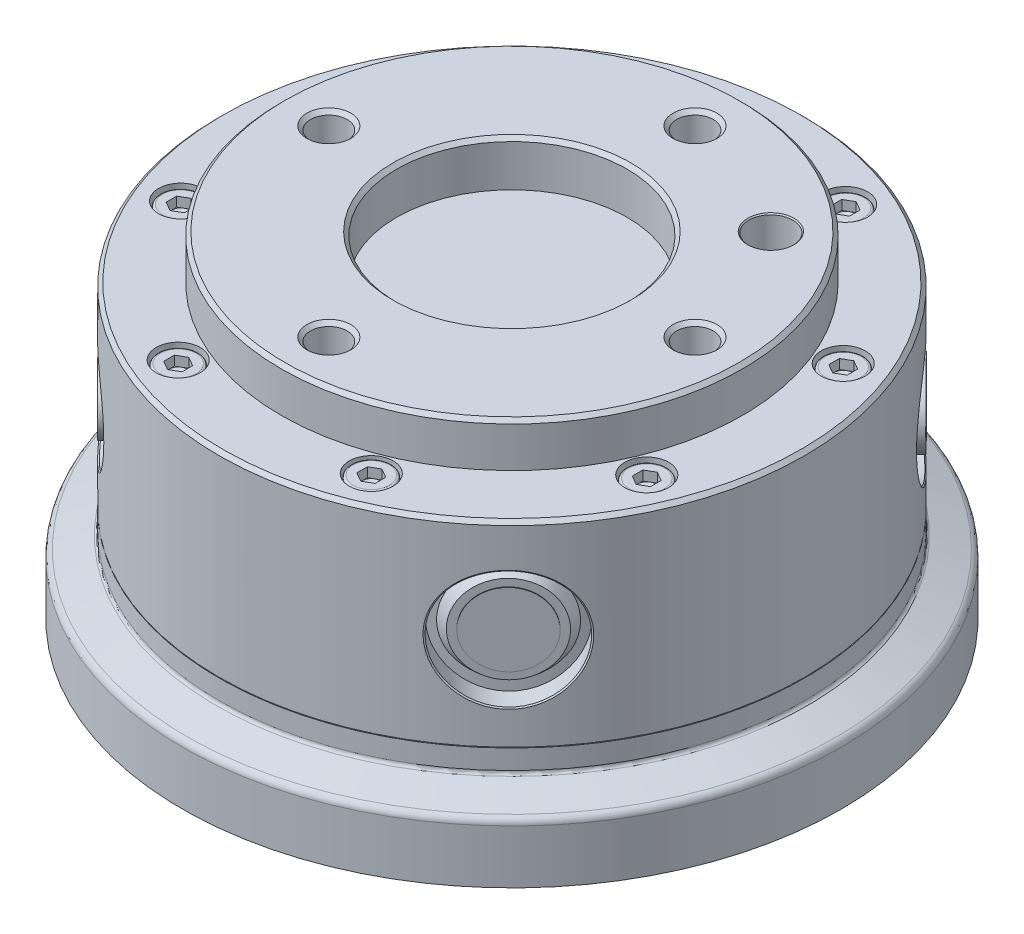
SolidWorks part; units mm, degrees
other "<4.0.08.2008488>-<移动面1>"
other "<4.0.08.2008488>-<移动面1>"
other "<4.0.08.2008488>-<移动面1>"
other "<4.0.08.2008488>-<移动面1>"
other "<4.0.08.2008488>-<移动面1>"
other "<4.0.08.2008488>-<移动面1>"
other "<4.0.08.2008488>-<移动面1>"
other "<4.0.08.2008488>-<移动面1>"
other "<2.2.08.2007166>-<凸台-拉伸5>"
other "<2.2.08.2011467>-<凸台-拉伸5>"
ref_plane "前视基准面" through (0, 0, 0) normal (0, 0, 1) x (1, 0, 0)
ref_plane "上视基准面" through (0, 0, 0) normal (0, 1, 0) x (1, 0, 0)
ref_plane "右视基准面" through (0, 0, 0) normal (1, 0, 0) x (0, 0, -1)
imported_body "7.7.00.8050056.STEP"
other "删除面1"
ref_plane "前视基准面-4.0.08.2008488" through (12.6568, -0.1822, 32.2196) normal (0, 0, 1) x (0, -1, 0)
ref_plane "上视基准面-4.0.08.2008488" through (12.6568, -0.1822, 32.2196) normal (1, 0, 0) x (0, -1, 0)
ref_plane "右视基准面-4.0.08.2008488" through (12.6568, -0.1822, 32.2196) normal (0, -1, 0) x (0, 0, -1)
inserted part "4.0.08.2008488"
move or copy body "实体-移动/复制4" placed by mates yes parameters "D1.移动面1"=2
ref_plane "前视基准面-4.0.08.20084883" through (31.6268, -0.4, 13.5779) normal (0, 0, 1) x (0, -1, 0)
ref_plane "上视基准面-4.0.08.20084883" through (31.6268, -0.4, 13.5779) normal (1, 0, 0) x (0, -1, 0)
ref_plane "右视基准面-4.0.08.20084883" through (31.6268, -0.4, 13.5779) normal (0, -1, 0) x (0, 0, -1)
inserted part "4.0.08.20084883"
move or copy body "实体-移动/复制6" placed by mates yes parameters "D1.移动面1"=2
ref_plane "前视基准面-4.0.08.20084884" through (31.8589, -0.4, -13.0176) normal (0, 0, 1) x (0, -1, 0)
ref_plane "上视基准面-4.0.08.20084884" through (31.8589, -0.4, -13.0176) normal (1, 0, 0) x (0, -1, 0)
ref_plane "右视基准面-4.0.08.20084884" through (31.8589, -0.4, -13.0176) normal (0, -1, 0) x (0, 0, -1)
inserted part "4.0.08.20084884"
move or copy body "实体-移动/复制8" placed by mates yes parameters "D1.移动面1"=2
ref_plane "前视基准面-4.0.08.20084885" through (13.2172, -0.4, -31.9875) normal (0, 0, 1) x (0, -1, 0)
ref_plane "上视基准面-4.0.08.20084885" through (13.2172, -0.4, -31.9875) normal (1, 0, 0) x (0, -1, 0)
ref_plane "右视基准面-4.0.08.20084885" through (13.2172, -0.4, -31.9875) normal (0, -1, 0) x (0, 0, -1)
inserted part "4.0.08.20084885"
move or copy body "实体-移动/复制10" placed by mates yes parameters "D1.移动面1"=2
ref_plane "前视基准面-4.0.08.20084886" through (-13.3783, -0.4, -32.2196) normal (0, 0, 1) x (0, -1, 0)
ref_plane "上视基准面-4.0.08.20084886" through (-13.3783, -0.4, -32.2196) normal (1, 0, 0) x (0, -1, 0)
ref_plane "右视基准面-4.0.08.20084886" through (-13.3783, -0.4, -32.2196) normal (0, -1, 0) x (0, 0, -1)
inserted part "4.0.08.20084886"
move or copy body "实体-移动/复制12" placed by mates yes parameters "D1.移动面1"=2
ref_plane "前视基准面-4.0.08.20084887" through (-32.3483, -0.4, -13.5779) normal (0, 0, 1) x (0, -1, 0)
ref_plane "上视基准面-4.0.08.20084887" through (-32.3483, -0.4, -13.5779) normal (1, 0, 0) x (0, -1, 0)
ref_plane "右视基准面-4.0.08.20084887" through (-32.3483, -0.4, -13.5779) normal (0, -1, 0) x (0, 0, -1)
inserted part "4.0.08.20084887"
move or copy body "实体-移动/复制14" placed by mates yes parameters "D1.移动面1"=2
ref_plane "前视基准面-4.0.08.20084888" through (-32.5804, -0.4, 13.0176) normal (0, 0, 1) x (0, -1, 0)
ref_plane "上视基准面-4.0.08.20084888" through (-32.5804, -0.4, 13.0176) normal (1, 0, 0) x (0, -1, 0)
ref_plane "右视基准面-4.0.08.20084888" through (-32.5804, -0.4, 13.0176) normal (0, -1, 0) x (0, 0, -1)
inserted part "4.0.08.20084888"
move or copy body "实体-移动/复制16" placed by mates yes parameters "D1.移动面1"=2
ref_plane "前视基准面-4.0.08.20084889" through (-13.9386, -0.4, 31.9875) normal (0, 0, 1) x (0, -1, 0)
ref_plane "上视基准面-4.0.08.20084889" through (-13.9386, -0.4, 31.9875) normal (1, 0, 0) x (0, -1, 0)
ref_plane "右视基准面-4.0.08.20084889" through (-13.9386, -0.4, 31.9875) normal (0, -1, 0) x (0, 0, -1)
inserted part "4.0.08.20084889" parameters "D1.移动面1"=2
move or copy body "实体-移动/复制18"
combine bodies "组合1" operation type add bodies to combine 102 104 105 106 107 108 109 110 111
ref_plane "基准面46" through (-28.4646, 0, -28.4646) normal (-0.7071, 0, -0.7071) x (0, 1, 0)
sketch "草图15" plane through (-28.4646, 0, -28.4646) normal (-0.7071, 0, -0.7071) x (0, 1, 0)
  line L0 (-14, 7.1365) -> (-14, -7.1308) construction
  circle A0 centre (-14, 0.0029) radius 6
  spline S1 degree 3 poles (-12.8936, 7.2445) (-14.1744, 7.37) (-15.687, 7.1657) (-17.0836, 6.6517) (-18.3371, 5.9193) (-19.4094, 4.9267) (-20.2247, 3.7709) (-20.7516, 2.6692) (-21.0867, 1.4943) (-21.2202, 0.2761) (-21.1481, -0.9452) (-20.872, -2.1383) (-20.3453, -3.4011) (-19.5272, -4.6123) (-18.4713, -5.6158) (-17.221, -6.4228) (-15.902, -6.9276) (-14.5172, -7.1467) (-13.1779, -7.1292) (-11.8617, -6.8514) (-10.4892, -6.266) (-9.2877, -5.4361) (-8.2964, -4.3697) (-7.6011, -3.2706) (-7.1292, -2.1424) (-6.8395, -0.8936) (-6.7697, 0.5685) (-7.0178, 2.0156) (-7.5301, 3.3163) (-8.1596, 4.359) (-8.9544, 5.2807) (-9.8913, 6.0553) (-10.9465, 6.6624) (-11.8758, 7.0049) (-12.8936, 7.2445) (-14.1744, 7.37) (-15.687, 7.1657) knots -0.069292 -0.042434 -0.03071 0 0.04228 0.069075 0.098362 0.138289 0.165245 0.192075 0.219062 0.245918 0.272901 0.299721 0.32669 0.363289 0.395955 0.422876 0.461776 0.488622 0.515367 0.55009 0.576997 0.614003 0.646217 0.673174 0.700009 0.726977 0.757739 0.79639 0.823259 0.850188 0.877002 0.903898 0.930708 0.957566 0.96929 1 1.04228 1.069075 1.098362 only from (-14, 7.3073) to (-14, 7.3073) construction
  dimension "D2" = 12
extrude "切除-拉伸4" cut sketch "草图15" against normal blind 10 contours A0
sketch "草图17" plane through (-28.4646, 0, -28.4646) normal (-0.7071, 0, -0.7071) x (0, 1, 0)
  circle A0 centre (-14, 0.0029) radius 4
  dimension "D1" = 8
extrude "凸台-拉伸1" add sketch "草图17" against normal up to surface (10 mm away)
pattern_circular "阵列(圆周)4" count 2 over 90 about axis through (-0.3607, -25.8, 0) along (0, 1, 0) of "切除-拉伸4"
sketch "草图18" plane through (-21.3936, 0, 21.3936) normal (-0.7071, 0, 0.7071) x (0.7071, 0, 0.7071)
  circle A0 centre (-0.513, -14) radius 4
  dimension "D1" = 8
extrude "凸台-拉伸2" add sketch "草图18" along normal blind 10
ref_plane "前视基准面-2.2.08.2011467" through (19.6816, -14, -19.6956) normal (0.7009, 0, 0.7133) x (0.7133, 0, -0.7009)
ref_plane "上视基准面-2.2.08.2011467" through (19.6816, -14, -19.6956) normal (0, 1, 0) x (0.7133, 0, -0.7009)
ref_plane "右视基准面-2.2.08.2011467" through (19.6816, -14, -19.6956) normal (0.7133, 0, -0.7009) x (-0.7009, 0, -0.7133)
sketch "草图1-2.2.08.2011467" plane through (19.6816, -14, -19.6956) normal (0.7009, 0, 0.7133) x (0.7133, 0, -0.7009)
  line L0 (28.4355, 0) -> (-28.9399, 0) construction
  line L1 (10.5, 0) -> (10.5, 6)
  line L2 (10.5, 6) -> (9, 6.95)
  line L3 (9, 6.95) -> (9, 6)
  line L4 (9, 6) -> (0, 6)
  line L5 (0, 6) -> (0, 0)
  line L6 (10.5, 0) -> (0, 0)
  dimension "D1" = 10.5
  dimension "D2" = 1.5
  dimension "D3" = 12
  dimension "D4" = 12
  dimension "D5" = 13.9
ref_plane "基准面1-2.2.08.2011467" through (22.5346, -14, -22.4992) normal (-0.7133, 0, 0.7009) x (0.7009, 0, 0.7133)
sketch "草图2-2.2.08.2011467" plane through (22.5346, -14, -22.4992) normal (-0.7133, 0, 0.7009) x (0.7009, 0, 0.7133)
  line L1 (-4.0076, 6.9364) -> (-8.0109, -0.0025)
  line L2 (-8.0109, -0.0025) -> (-4.0033, -6.9388)
  line L3 (-4.0033, -6.9388) -> (4.0076, -6.9364)
  line L4 (4.0076, -6.9364) -> (8.0109, 0.0025)
  line L5 (8.0109, 0.0025) -> (4.0033, 6.9388)
  line L6 (4.0033, 6.9388) -> (-4.0076, 6.9364)
  circle A0 centre (0, 0) radius 6.9376 construction
sketch "草图3-2.2.08.2011467" plane through (19.6816, -14, -19.6956) normal (-0.7133, 0, 0.7009) x (0.7009, 0, 0.7133)
  circle A0 centre (2.19, 2.4875) radius 0.774
sketch "草图4-2.2.08.2011467" plane through (19.6816, -14, -19.6956) normal (-0.7133, 0, 0.7009) x (0.7009, 0, 0.7133)
  circle A1 centre (0, 0) radius 6
  circle A2 centre (0, 0) radius 5.0159
sketch "草图5-2.2.08.2011467" plane through (27.1707, -14, -27.0551) normal (0.7133, 0, -0.7009) x (-0.7009, 0, -0.7133)
  circle A0 centre (0, 0) radius 4.9976
sketch "草图6-2.2.08.2011467" plane through (21.1081, -14, -21.0974) normal (-0.7133, 0, 0.7009) x (0.7009, 0, 0.7133)
  circle A0 centre (0, 0) radius 8.0109
inserted part "2.2.08.2011467" parameters "D1.旋转1"=360, "D1.草图1"=10.5, "D2.草图1"=1.5, "D3.草图1"=12, "D4.草图1"=12, "D5.草图1"=13.9, "D1.基准面1"=5, "D1.凸台-拉伸1"=2, "D1.凸台-拉伸2"=4, "D3.阵列(圆周)1"=360, "D1.阵列(圆周)1"=4, "D1.凸台-拉伸4"=1.4, "D1.凸台-拉伸5"=0.5
move or copy body "实体-移动/复制20"
other "移动面2" parameters "D1"=1.3
ref_plane "前视基准面-2.2.08.2007166" through (19.0544, -14, 19.757) normal (-0.7133, 0, 0.7009) x (0.7009, 0, 0.7133)
ref_plane "上视基准面-2.2.08.2007166" through (19.0544, -14, 19.757) normal (0, 1, 0) x (0.7009, 0, 0.7133)
ref_plane "右视基准面-2.2.08.2007166" through (19.0544, -14, 19.757) normal (0.7009, 0, 0.7133) x (0.7133, 0, -0.7009)
sketch "草图1-2.2.08.2007166" plane through (19.0544, -14, 19.757) normal (-0.7133, 0, 0.7009) x (0.7009, 0, 0.7133)
  line L0 (28.4355, 0) -> (-28.9399, 0) construction
  line L1 (10.5, 0) -> (10.5, 6)
  line L2 (10.5, 6) -> (9, 6.95)
  line L3 (9, 6.95) -> (9, 6)
  line L4 (9, 6) -> (0, 6)
  line L5 (0, 6) -> (0, 0)
  line L6 (10.5, 0) -> (0, 0)
  dimension "D1" = 10.5
  dimension "D2" = 1.5
  dimension "D3" = 12
  dimension "D4" = 12
  dimension "D5" = 13.9
ref_plane "基准面1-2.2.08.2007166" through (21.8581, -14, 22.61) normal (-0.7009, 0, -0.7133) x (-0.7133, 0, 0.7009)
sketch "草图2-2.2.08.2007166" plane through (21.8581, -14, 22.61) normal (-0.7009, 0, -0.7133) x (-0.7133, 0, 0.7009)
  line L1 (-4.0076, 6.9364) -> (-8.0109, -0.0025)
  line L2 (-8.0109, -0.0025) -> (-4.0033, -6.9388)
  line L3 (-4.0033, -6.9388) -> (4.0076, -6.9364)
  line L4 (4.0076, -6.9364) -> (8.0109, 0.0025)
  line L5 (8.0109, 0.0025) -> (4.0033, 6.9388)
  line L6 (4.0033, 6.9388) -> (-4.0076, 6.9364)
  circle A0 centre (0, 0) radius 6.9376 construction
sketch "草图3-2.2.08.2007166" plane through (19.0544, -14, 19.757) normal (-0.7009, 0, -0.7133) x (-0.7133, 0, 0.7009)
  circle A0 centre (2.19, 2.4875) radius 0.774
sketch "草图4-2.2.08.2007166" plane through (19.0544, -14, 19.757) normal (-0.7009, 0, -0.7133) x (-0.7133, 0, 0.7009)
  circle A1 centre (0, 0) radius 6
  circle A2 centre (0, 0) radius 5.0159
sketch "草图5-2.2.08.2007166" plane through (26.414, -14, 27.2462) normal (0.7009, 0, 0.7133) x (0.7133, 0, -0.7009)
  circle A0 centre (0, 0) radius 4.9976
sketch "草图6-2.2.08.2007166" plane through (20.4563, -14, 21.1835) normal (-0.7009, 0, -0.7133) x (-0.7133, 0, 0.7009)
  circle A0 centre (0, 0) radius 8.0109
inserted part "2.2.08.2007166" parameters "D1.旋转1"=360, "D1.草图1"=10.5, "D2.草图1"=1.5, "D3.草图1"=12, "D4.草图1"=12, "D5.草图1"=13.9, "D1.基准面1"=5, "D1.凸台-拉伸1"=2, "D1.凸台-拉伸2"=4, "D3.阵列(圆周)1"=360, "D1.阵列(圆周)1"=4, "D1.凸台-拉伸4"=0.1, "D1.凸台-拉伸5"=0.5
move or copy body "实体-移动/复制22"
other "移动面3" parameters "D1"=0.5
combine bodies "组合4" operation type add bodies to combine 120 121 123
other "移动面4" parameters "D1"=0.55
other "移动面5" parameters "D1"=0.55
chamfer "倒角1" distance 0.2 angle 45 2 edges at (32.7435, -12.3288, 22.4523) (22.0916, -12.3288, -33.1043)
